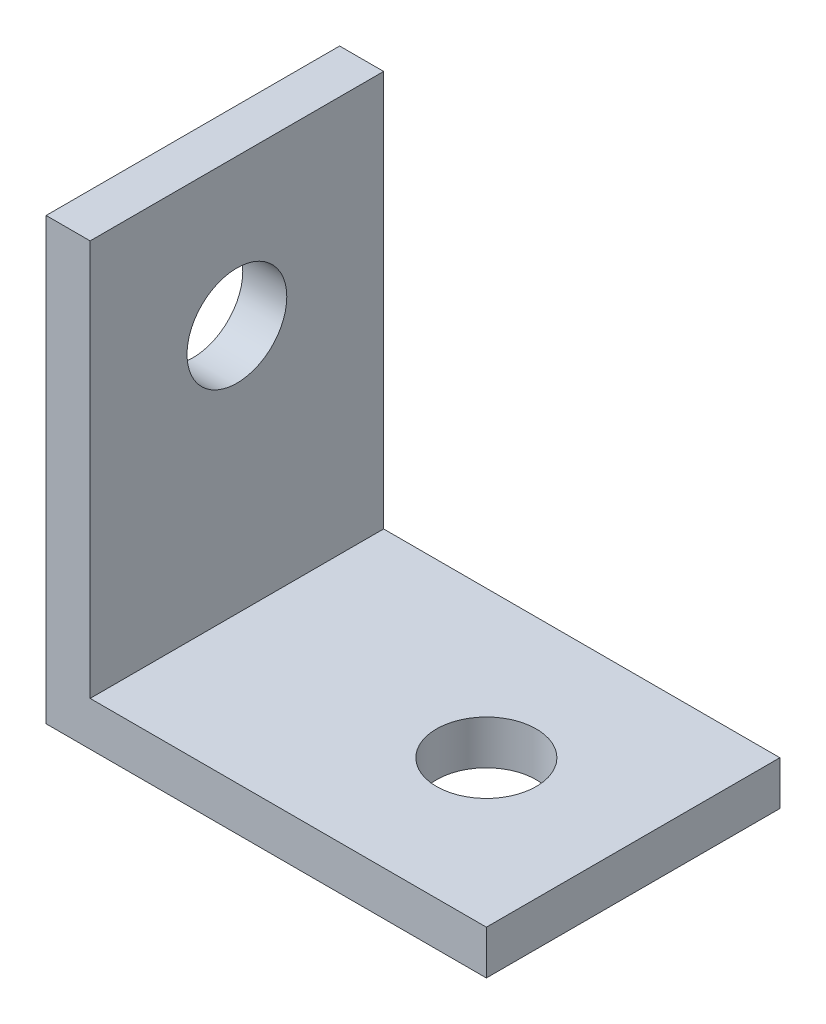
SolidWorks part; units mm, degrees
ref_plane "前视基准面" through (0, 0, 0) normal (0, 0, 1) x (1, 0, 0)
ref_plane "上视基准面" through (0, 0, 0) normal (0, 1, 0) x (1, 0, 0)
ref_plane "右视基准面" through (0, 0, 0) normal (1, 0, 0) x (0, 0, -1)
sketch "草图1" plane through (0, 0, 0) normal (0, 0, 1) x (1, 0, 0)
  line L1 (-7.5, 7.5) -> (7.5, 7.5)
  line L2 (-7.5, 7.5) -> (-7.5, -7.5)
  line L3 (-7.5, -7.5) -> (7.5, -7.5)
  line L4 (7.5, 7.5) -> (7.5, -7.5)
  line L5 (-7.5, 7.5) -> (7.5, -7.5) construction
  line L6 (-7.5, -7.5) -> (7.5, 7.5) construction
  point P0 (0, 0)
  dimension "D1" = 15
  dimension "D2" = 15
extrude "凸台-拉伸1" add sketch "草图1" along normal blind 10
sketch "草图2" plane through (0, 0, 10) normal (0, 0, 1) x (1, 0, 0)
  line L0 (-7.5, 7.5) -> (-7.5, -7.5) construction
  line L1 (21, 21) -> (-6, 21)
  line L2 (21, 21) -> (21, -6)
  line L3 (21, -6) -> (-6, -6)
  line L4 (-6, 21) -> (-6, -6)
  line L5 (21, 21) -> (-6, -6) construction
  line L6 (21, -6) -> (-6, 21) construction
  line L7 (-7.5, -7.5) -> (7.5, -7.5) construction
  point P0 (7.5, 7.5)
  dimension "D1" = 1.5
  dimension "D2" = 1.5
extrude "切除-拉伸1" cut sketch "草图2" against normal blind 10
hole_wizard "Ø3.4 (3.4) 直径孔1" positions "草图3" profile "草图4" hole size "Ø3.4" standard "GB"
sketch "草图3" plane through (-6, 0, 0) normal (1, 0, 0) x (0, 0, -1)
  line L0 (0, 7.5) -> (0, -6) construction
  line L1 (-10, 7.5) -> (0, 7.5) construction
  point P0 (-5, 2.5)
  dimension "D1" = 5
  dimension "D2" = 5
sketch "草图4" plane through (-6, 2.5, 5) normal (0, 1, 0) x (0, 0, -1)
  line L0 (0, 0) -> (0, 1.5)
  line L1 (0, 1.5) -> (1.7, 1.5)
  line L2 (1.7, 1.5) -> (1.7, 0)
  line L5 (1.7, 0) -> (0, 0)
  line L11 (0, -6.35) -> (0, 107.95) construction
  dimension "通孔孔直径" = 3.4
  dimension "通孔孔深度" = 1.5
hole_wizard "Ø3.4 (3.4) 直径孔2" positions "草图5" profile "草图6" hole size "Ø3.4" standard "GB"
sketch "草图5" plane through (0, -6, 0) normal (0, 1, 0) x (1, 0, 0)
  line L0 (-6, 0) -> (7.5, 0) construction
  line L1 (7.5, 0) -> (7.5, -10) construction
  point P0 (2.5, -5)
  dimension "D1" = 5
  dimension "D2" = 5
sketch "草图6" plane through (2.5, -6, 5) normal (1, 0, 0) x (0, 0, 1)
  line L0 (0, 0) -> (0, 1.5)
  line L1 (0, 1.5) -> (1.7, 1.5)
  line L2 (1.7, 1.5) -> (1.7, 0)
  line L5 (1.7, 0) -> (0, 0)
  line L11 (0, -6.35) -> (0, 107.95) construction
  dimension "通孔孔直径" = 3.4
  dimension "通孔孔深度" = 1.5
